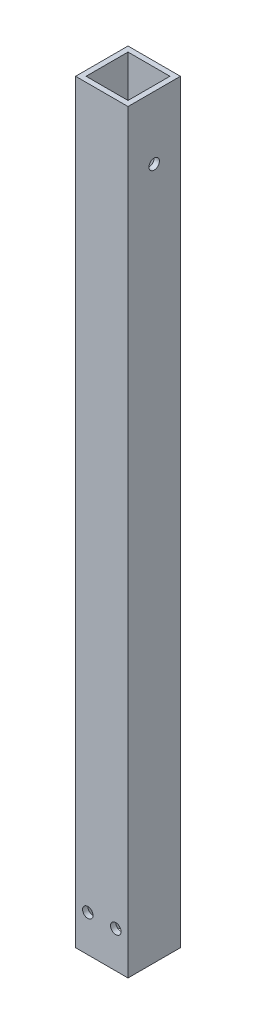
SolidWorks part; units mm, degrees
ref_plane "Front" through (0, 0, 0) normal (0, 0, 1) x (1, 0, 0)
ref_plane "Top" through (0, 0, 0) normal (0, 1, 0) x (1, 0, 0)
ref_plane "Right" through (0, 0, 0) normal (1, 0, 0) x (0, 0, -1)
sketch "草图1" plane through (0, 0, 0) normal (0, 1, 0) x (1, 0, 0)
  line L1 (-7.5, -7.5) -> (7.5, -7.5)
  line L2 (-7.5, -7.5) -> (-7.5, 7.5)
  line L3 (-7.5, 7.5) -> (7.5, 7.5)
  line L4 (7.5, -7.5) -> (7.5, 7.5)
  line L5 (-7.5, -7.5) -> (7.5, 7.5) construction
  line L6 (-7.5, 7.5) -> (7.5, -7.5) construction
  line L7 (-6, -6) -> (6, -6)
  line L8 (-6, -6) -> (-6, 6)
  line L9 (-6, 6) -> (6, 6)
  line L10 (6, -6) -> (6, 6)
  line L11 (-6, -6) -> (6, 6) construction
  line L12 (-6, 6) -> (6, -6) construction
  point P1 (0, 0)
  point P6 (0, 0)
  dimension "D1" = 15
  dimension "D2" = 15
  dimension "D3" = 1.5
extrude "凸台-拉伸1" add sketch "草图1" along normal blind 241
sketch "草图3" plane through (7.5, 0, 0) normal (1, 0, 0) x (0, 0, -1)
  line L0 (-7.5, 241) -> (7.5, 241) construction
  line L2 (7.5, 241) -> (7.5, 0) construction
  circle A0 centre (0, 223) radius 1.5
  dimension "D1" = 18
  dimension "D2" = 3
  dimension "D3" = 7.5
extrude "切除-拉伸2" cut sketch "草图3" against normal up to surface (15 mm away)
sketch "草图4" plane through (0, 0, 7.5) normal (0, 0, 1) x (1, 0, 0)
  line L0 (-7.5, 241) -> (-7.5, 0) construction
  line L1 (-7.5, 0) -> (7.5, 0) construction
  circle A0 centre (-2.5, 8) radius 1.5
  dimension "D1" = 5
  dimension "D2" = 8
  dimension "D3" = 3
extrude "切除-拉伸3" cut sketch "草图4" against normal up to surface (15 mm away)
sketch "草图5" plane through (-7.5, 0, 0) normal (-1, 0, 0) x (0, 0, 1)
  line L0 (7.5, 241) -> (7.5, 0) construction
  line L1 (-7.5, 0) -> (7.5, 0) construction
  circle A0 centre (0, 15) radius 3
  dimension "D1" = 7.5
  dimension "D2" = 15
  dimension "D3" = 6
extrude "切除-拉伸4" cut sketch "草图5" against normal up to surface (15 mm away)
sketch "草图6" plane through (7.5, 0, 0) normal (1, 0, 0) x (0, 0, -1)
  line L2 (-7.5, 241) -> (-7.5, 0) construction
  line L3 (-7.5, 0) -> (7.5, 0) construction
  circle A1 centre (0, 30) radius 1.5
  circle A3 centre (0, 38) radius 1.5
  dimension "D1" = 7.5
  dimension "D6" = 3
  dimension "D7" = 3
  dimension "D2" = 8
  dimension "D3" = 30
  dimension "D4" = 7.5
extrude "切除-拉伸5" [suppressed] cut sketch "草图6" against normal up to surface (15 mm away)
sketch "草图7" plane through (7.5, 0, 0) normal (1, 0, 0) x (0, 0, -1)
  circle A0 centre (0, 15) radius 3
  dimension "D1" = 6
sketch "草图8" plane through (-7.5, 0, 0) normal (-1, 0, 0) x (0, 0, 1)
  line L0 (-7.5, 241) -> (-7.5, 0) construction
  line L1 (-7.5, 25) -> (7.5, 25)
  line L2 (-7.5, 25) -> (-7.5, 0)
  line L3 (-7.5, 0) -> (7.5, 0)
  line L4 (7.5, 25) -> (7.5, 0)
  circle A0 centre (0, 15) radius 3 construction
  dimension "D1" = 10
extrude "切除-拉伸7" cut sketch "草图8" against normal through all
hole_wizard "Ø5.0 (5) 直径孔1" positions "草图9" profile "草图10" hole size "Ø5.0" standard "GB"
sketch "草图9" plane through (4, 0, 0) normal (-1, 0, 0) x (0, 0, 1)
  point P0 (0, 20.5)
  point P3 (0, 3.5)
sketch "草图10" plane through (4, 20.5, 0) normal (0, 1, 0) x (0, 0, 1)
  line L0 (0, 0) -> (0, 1)
  line L1 (0, 1) -> (2.5, 1)
  line L2 (2.5, 1) -> (2.5, 0)
  line L5 (2.5, 0) -> (0, 0)
  line L11 (0, -6.35) -> (0, 107.95) construction
  dimension "通孔孔直径" = 5
  dimension "通孔孔深度" = 1
hole_wizard "Ø3.0 (3) 直径孔1" positions "草图11" profile "草图12" hole size "Ø3.0" standard "GB"
sketch "草图11" plane through (0, 0, 7.5) normal (0, 0, 1) x (1, 0, 0)
  line L0 (7.5, 25) -> (-7.5, 25) construction
  point P0 (4, 35.5)
  point P3 (-4, 35.5)
  dimension "D1" = 8
  dimension "D2" = 4
  dimension "D3" = 10.5
sketch "草图12" plane through (4, 35.5, 7.5) normal (1, 0, 0) x (0, -1, 0)
  line L0 (0, 0) -> (0, 15)
  line L1 (0, 15) -> (1.5, 15)
  line L2 (1.5, 15) -> (1.5, 0)
  line L5 (1.5, 0) -> (0, 0)
  line L11 (0, -6.35) -> (0, 107.95) construction
  dimension "通孔孔直径" = 3
  dimension "通孔孔深度" = 15
